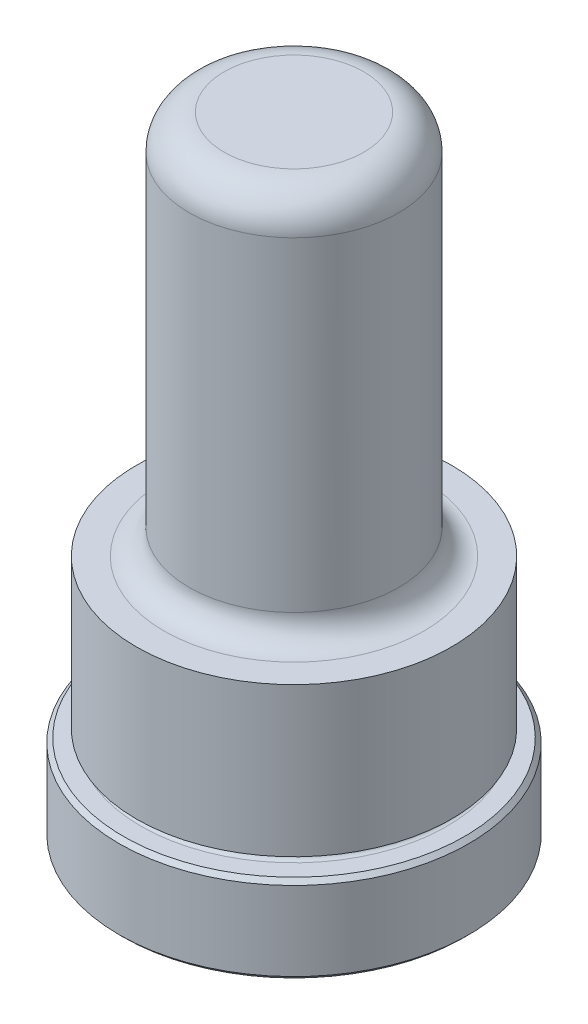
SolidWorks part; units mm, degrees
ref_plane "Front Plane" through (0, 0, 0) normal (0, 0, 1) x (1, 0, 0)
ref_plane "Top Plane" through (0, 0, 0) normal (0, 1, 0) x (1, 0, 0)
ref_plane "Right Plane" through (0, 0, 0) normal (1, 0, 0) x (0, 0, -1)
sketch "Sketch1" plane through (0, 0, 0) normal (1, 0, 0) x (0, 0, -1)
  line L0 (0, 0) -> (15.875, 0)
  line L1 (15.875, 0) -> (15.875, 7.9248)
  line L2 (15.875, 7.9248) -> (13.8938, 7.9248)
  line L3 (13.5128, 2.6782) -> (13.5128, 5.9795) construction
  line L4 (13.8938, 8.6868) -> (14.3002, 8.6868)
  line L5 (14.3002, 8.6868) -> (14.3002, 22.225)
  line L6 (14.3002, 22.225) -> (11.7983, 22.225)
  line L7 (9.5123, 24.511) -> (9.5123, 57.15)
  line L9 (9.5123, 57.15) -> (0, 57.15)
  line L10 (0, 57.15) -> (0, 0)
  line L11 (0, 0) -> (0, -7.2694) construction
  arc A0 (13.8938, 8.6868) -> (13.8938, 7.9248) centre (13.8938, 8.3058) ccw
  arc A1 (11.7983, 22.225) -> (9.5123, 24.511) centre (11.7983, 24.511) cw
  point P2 (9.5123, 57.15)
  point P14 (9.5123, 57.0322)
  point P19 (9.5123, 22.225)
  dimension "D14" = 0.762
  dimension "D8" = 2.286
  dimension "T" = 7.9248
  dimension "D2" = 0.762
  dimension "M" = 31.75
  dimension "B" = 28.6004
  dimension "L" = 57.15
  dimension "D7" = 0.7874
  dimension "A" = 22.225
  dimension "D" = 19.0246
  dimension "D15" = 34.925
revolve "Revolve1" add sketch "Sketch1" angle 360 about L11
chamfer "Chamfer1" distance 0.381 angle 45 2 edges at (0, 0, 15.875) (0, 7.9248, 15.875)
fillet "Fillet1" radius 3.175 1 edges at (0, 57.15, 9.5123)
